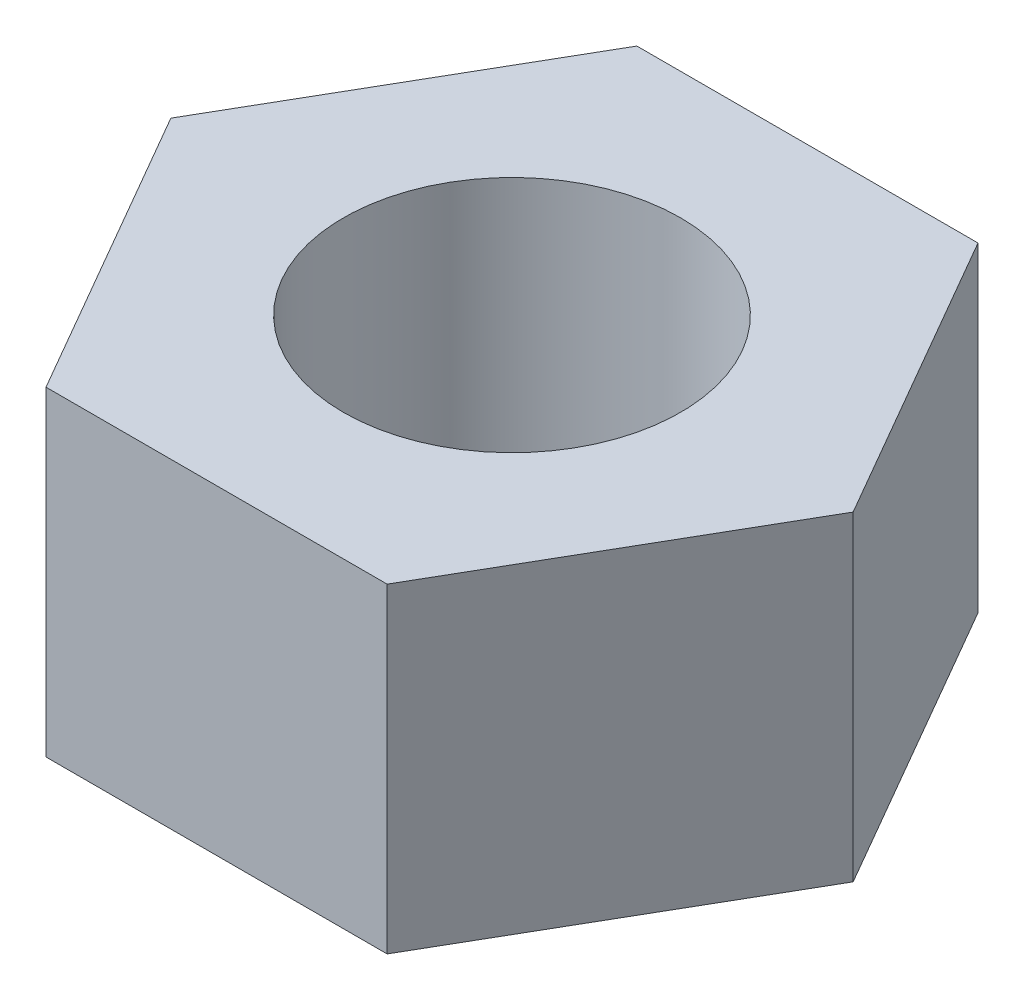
SolidWorks part; units mm, degrees
ref_plane "Front Plane" through (0, 0, 0) normal (0, 0, 1) x (1, 0, 0)
ref_plane "Top Plane" through (0, 0, 0) normal (0, 1, 0) x (1, 0, 0)
ref_plane "Right Plane" through (0, 0, 0) normal (1, 0, 0) x (0, 0, -1)
sketch "Sketch1" plane through (0, 0, 0) normal (0, 1, 0) x (1, 0, 0)
  line L1 (-2.0237, 3.5052) -> (-4.0475, 0)
  line L2 (-4.0475, 0) -> (-2.0237, -3.5052)
  line L3 (-2.0237, -3.5052) -> (2.0237, -3.5052)
  line L4 (2.0237, -3.5052) -> (4.0475, 0)
  line L5 (4.0475, 0) -> (2.0237, 3.5052)
  line L6 (2.0237, 3.5052) -> (-2.0237, 3.5052)
  circle A0 centre (0, 0) radius 2
  circle A1 centre (0, 0) radius 3.5052 construction
  dimension "D1" = 4
  dimension "D2" = 7.0104
extrude "Boss-Extrude1" add sketch "Sketch1" along normal blind 3.8
